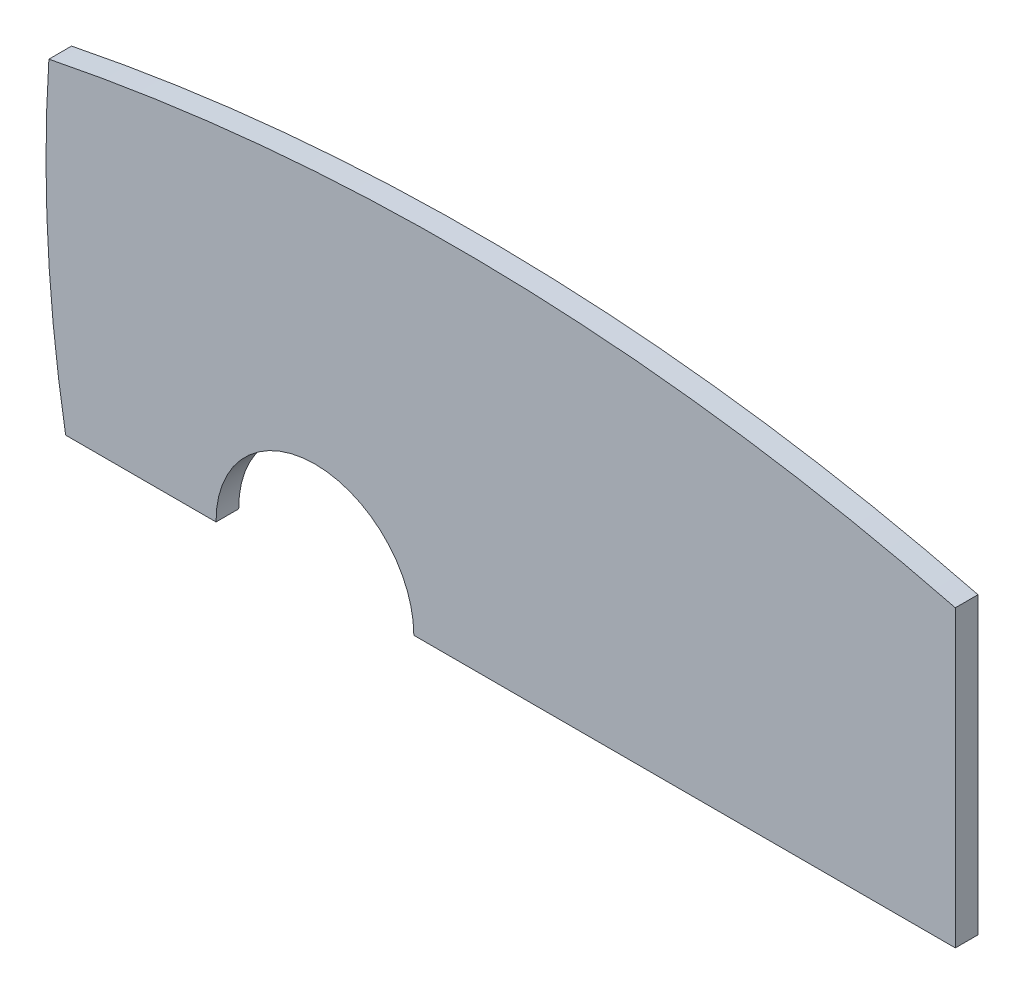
SolidWorks part; units mm, degrees
ref_plane "Ebene vorne" through (0, 0, 0) normal (0, 0, 1) x (1, 0, 0)
ref_plane "Ebene oben" through (0, 0, 0) normal (0, 1, 0) x (1, 0, 0)
ref_plane "Ebene rechts" through (0, 0, 0) normal (1, 0, 0) x (0, 0, -1)
sketch "Skizze1" plane through (0, 0, 0) normal (0, 0, 1) x (1, 0, 0)
  line L0 (-196.3052, -65.1677) -> (-163.1152, -65.1677)
  line L1 (-119.4781, -65) -> (0, -65)
  line L2 (0, -65) -> (0, 0)
  arc A0 (0, 0) -> (-200, 4.8323) centre (-110.5975, -436.1974) ccw
  arc A1 (-200, 4.8323) -> (-196.3052, -65.1677) centre (96.579, -14.611) ccw
  arc A2 (-163.1152, -65.1677) -> (-119.4781, -65) centre (-141.297, -65) cw
  point P12 (-388.6803, 102.8102)
  dimension "D2" = 70
  dimension "D3" = 21.8189
  dimension "D1" = 200
  dimension "D4" = 119.4781
  dimension "D5" = 65
extrude "Linear austragen1" add sketch "Skizze1" along normal blind 5
